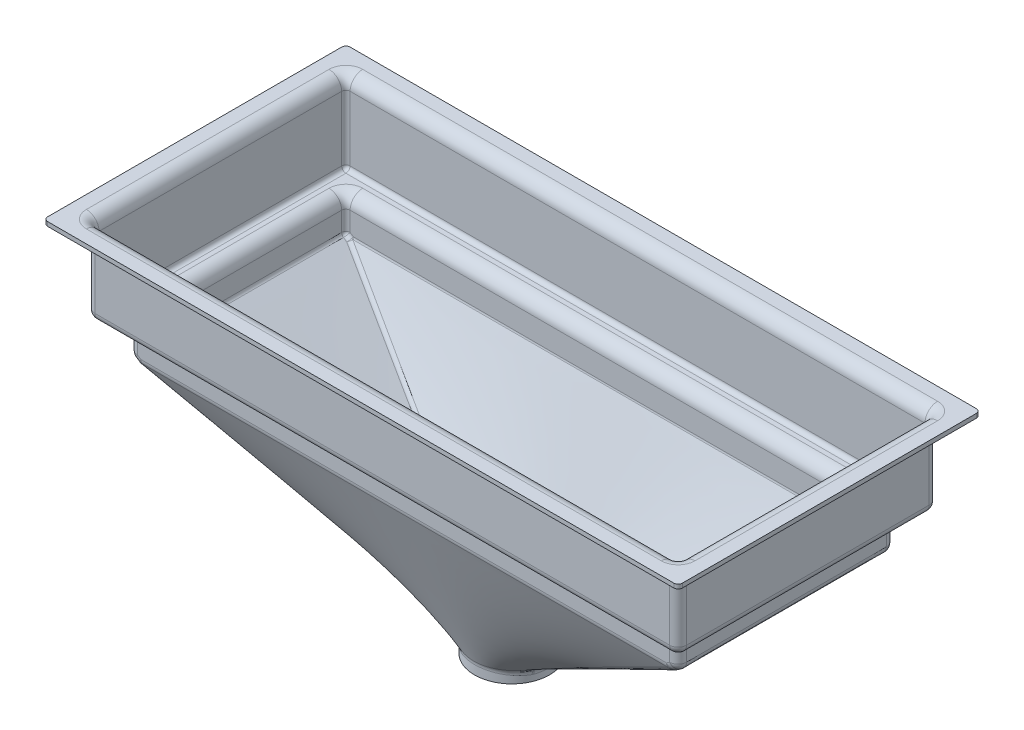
SolidWorks part; units mm, degrees
ref_plane "Front Plane" through (0, 0, 0) normal (0, 0, 1) x (1, 0, 0)
ref_plane "Top Plane" through (0, 0, 0) normal (0, 1, 0) x (1, 0, 0)
ref_plane "Right Plane" through (0, 0, 0) normal (1, 0, 0) x (0, 0, -1)
sketch "Sketch1" plane through (0, 0, 0) normal (0, 1, 0) x (1, 0, 0)
  line L1 (-376, -179.15) -> (376, -179.15)
  line L2 (-376, -179.15) -> (-376, 179.15)
  line L3 (-376, 179.15) -> (376, 179.15)
  line L4 (376, -179.15) -> (376, 179.15)
  line L5 (-376, -179.15) -> (376, 179.15) construction
  line L6 (-376, 179.15) -> (376, -179.15) construction
  point P0 (0, 0)
  dimension "D1" = 752
  dimension "D2" = 358.3
extrude "Boss-Extrude1" add sketch "Sketch1" against normal blind 5
sketch "Sketch2" plane through (0, 0, 0) normal (0, 1, 0) x (1, 0, 0)
  line L8 (350.6, -153.75) -> (350.6, 153.75)
  line L9 (350.6, 153.75) -> (-350.6, 153.75)
  line L10 (-350.6, 153.75) -> (-350.6, -153.75)
  line L11 (-350.6, -153.75) -> (350.6, -153.75)
  line L12 (350.6, -153.75) -> (350.6, 153.75)
  line L13 (350.6, 153.75) -> (-350.6, 153.75)
  line L14 (-350.6, 153.75) -> (-350.6, -153.75)
  line L15 (-350.6, -153.75) -> (350.6, -153.75)
  dimension "D1" = 25.4
extrude "Boss-Extrude2" add sketch "Sketch2" against normal blind 101.6
sketch "Sketch3" plane through (0, 0, 0) normal (0, 1, 0) x (1, 0, 0)
  line L8 (325.2, -128.35) -> (325.2, 128.35)
  line L9 (325.2, 128.35) -> (-325.2, 128.35)
  line L10 (-325.2, 128.35) -> (-325.2, -128.35)
  line L11 (-325.2, -128.35) -> (325.2, -128.35)
  line L12 (325.2, -128.35) -> (325.2, 128.35)
  line L13 (325.2, 128.35) -> (-325.2, 128.35)
  line L14 (-325.2, 128.35) -> (-325.2, -128.35)
  line L15 (-325.2, -128.35) -> (325.2, -128.35)
  dimension "D1" = 50.8
extrude "Boss-Extrude3" add sketch "Sketch3" against normal blind 139.7
sketch "Sketch7" plane through (0, 0, 0) normal (0, 1, 0) x (1, 0, 0)
  line L12 (17.0269, -97.8143) -> (23.5479, 94.9161)
  line L13 (23.5479, 94.9161) -> (-27.8952, 94.9161)
  line L14 (-27.8952, 94.9161) -> (-52.5299, -91.2934)
  line L15 (-52.5299, -91.2934) -> (17.0269, -97.8143)
extrude "Boss-Extrude5" add sketch "Sketch7" against normal blind 177.8
ref_plane "Plane1" through (0, -334.402, 0) normal (0, 1, 0) x (-1, 0, 0)
sketch "Sketch4" plane through (0, -334.402, 0) normal (0, 1, 0) x (-1, 0, 0)
  circle A0 centre (0, 0) radius 44.45
  dimension "D1" = 88.9
sketch "Sketch8" plane through (0, -139.7, 0) normal (0, -1, 0) x (1, 0, 0)
  line L0 (-325.2, -128.35) -> (-325.2, 128.35) construction
  line L1 (325.2, 128.35) -> (325.2, -128.35) construction
  line L2 (325.2, 128.35) -> (325.2, -128.35) construction
  line L8 (325.2, 128.35) -> (-325.2, 128.35)
  line L9 (-325.2, 128.35) -> (-325.2, -128.35)
  line L10 (-325.2, -128.35) -> (325.2, -128.35)
  line L11 (325.2, -128.35) -> (325.2, 128.35)
fillet "Fillet5" radius 5 4 edges at (-376, -2.5, -179.15) (-376, -2.5, 179.15) (376, -2.5, -179.15) (376, -2.5, 179.15)
loft "Loft1" add profiles "Sketch8", "Sketch4"
sketch "Sketch9" plane through (0, -334.402, 0) normal (0, -1, 0) x (1, 0, 0)
  arc A4 (-41.3462, 16.3185) -> (-41.3462, -16.3185) centre (0, 0) ccw
  arc A5 (-41.3462, -16.3185) -> (41.3462, -16.3185) centre (0, 0) ccw
  arc A6 (41.3462, -16.3185) -> (41.3462, 16.3185) centre (0, 0) ccw
  arc A7 (41.3462, 16.3185) -> (-41.3462, 16.3185) centre (0, 0) ccw
  arc A8 (-41.3462, 16.3185) -> (-41.3462, -16.3185) centre (0, 0) ccw
  arc A9 (-41.3462, -16.3185) -> (41.3462, -16.3185) centre (0, 0) ccw
  arc A10 (41.3462, -16.3185) -> (41.3462, 16.3185) centre (0, 0) ccw
  arc A11 (41.3462, 16.3185) -> (-41.3462, 16.3185) centre (0, 0) ccw
  dimension "D1" = 0
extrude "Boss-Extrude6" add sketch "Sketch9" along normal blind 12.7
fillet "Fillet6" radius 10 32 edges at (-350.6, -101.6, 0) (-350.6, -5, 0) (-325.2, -101.6, 0) (-325.2, -120.65, 128.35) (0, -101.6, 128.35) (325.2, -120.65, 128.35) (325.2, -101.6, 0) (-325.2, -120.65, -128.35) (325.2, -120.65, -128.35) (0, -101.6, -128.35) (0, -101.6, -153.75) (0, -5, -153.75) (-350.6, -53.3, -153.75) (350.6, -101.6, 0) (350.6, -5, 0) (350.6, -53.3, -153.75) (0, -101.6, 153.75) (-350.6, -53.3, 153.75) (0, -5, 153.75) (350.6, -53.3, 153.75) (-325.2, -139.7, 0) (0, -139.7, 128.35) (325.2, -139.7, 0) (0, -139.7, -128.35)
shell "Shell1" thickness 5
